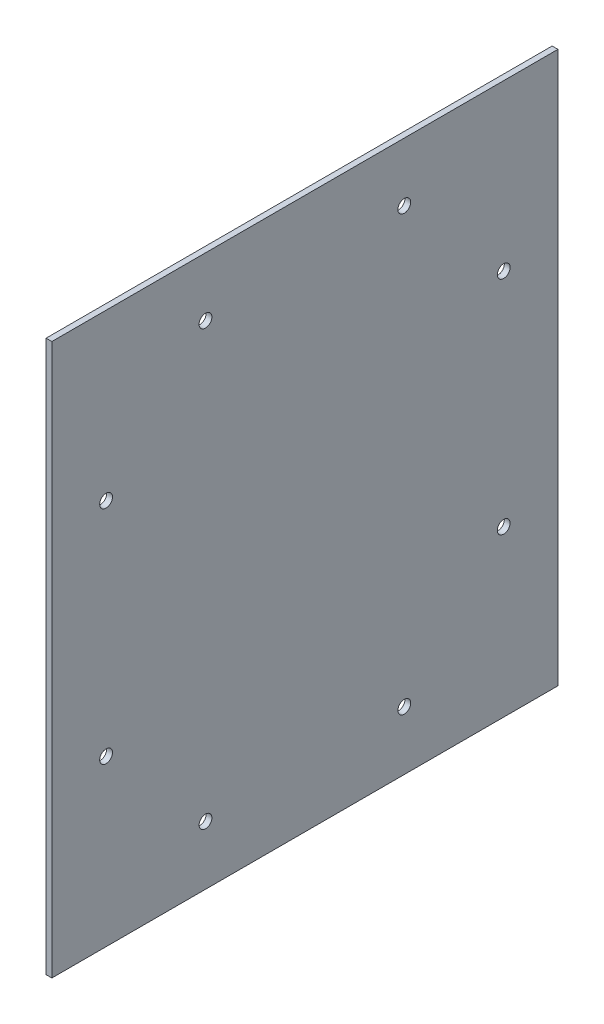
SolidWorks part; units mm, degrees
ref_plane "X-Y Datum" through (0, 0, 0) normal (0, 0, 1) x (1, 0, 0)
ref_plane "X-Z Datum" through (0, 0, 0) normal (0, 1, 0) x (1, 0, 0)
ref_plane "Y-Z Datum" through (0, 0, 0) normal (1, 0, 0) x (0, 0, -1)
sketch "Sketch1" plane through (0, 0, 0) normal (1, 0, 0) x (0, 0, -1)
  line L0 (69.85, -152.4) -> (-69.85, -152.4) construction
  line L1 (-177.8, -193.675) -> (177.8, -193.675)
  line L2 (-177.8, -193.675) -> (-177.8, 193.675)
  line L3 (-177.8, 193.675) -> (177.8, 193.675)
  line L4 (177.8, -193.675) -> (177.8, 193.675)
  line L5 (-177.8, -193.675) -> (177.8, 193.675) construction
  line L6 (-177.8, 193.675) -> (177.8, -193.675) construction
  line L7 (-139.7, -77.7875) -> (-139.7, 77.7875) construction
  line L8 (-69.85, -152.4) -> (-139.7, -77.7875) construction
  line L9 (55, 0) -> (-55, 0) construction
  line L10 (0, 55) -> (0, -55) construction
  line L11 (69.85, -152.4) -> (139.7, -77.7875) construction
  line L12 (139.7, -77.7875) -> (139.7, 77.7875) construction
  line L13 (139.7, 77.7875) -> (69.85, 152.4) construction
  line L14 (69.85, 152.4) -> (-69.85, 152.4) construction
  line L15 (-69.85, 152.4) -> (-139.7, 77.7875) construction
  circle A0 centre (69.85, -152.4) radius 4.0005
  circle A1 centre (-69.85, -152.4) radius 4.0005
  circle A2 centre (-139.7, -77.7875) radius 4.0005
  circle A3 centre (-139.7, 77.7875) radius 4.0005
  circle A4 centre (69.85, 152.4) radius 4.0005
  circle A5 centre (-69.85, 152.4) radius 4.0005
  circle A6 centre (139.7, 77.7875) radius 4.0005
  circle A7 centre (139.7, -77.7875) radius 4.0005
  point P0 (0, 0)
  point P10 (0, -152.4)
  point P15 (-139.7, 0)
  dimension "D4" = 8.001
  dimension "D1" = 387.35
  dimension "D2" = 355.6
  dimension "D3" = 41.275
  dimension "D5" = 139.7
  dimension "D6" = 155.575
  dimension "D7" = 38.1
  dimension "D8" = 102.2059
extrude "Boss-Extrude1" add sketch "Sketch1" along normal blind 4.064 contours L1 L4 L3 L2 A6 A4 A3 A2 A1 A0 A5 A7 | A1 | A0 | A7 | A6 | A4 | A5 | A3 | A2
hole_wizard "M8 Clearance Hole1" positions "Sketch2" profile "Sketch3" hole size "M8" standard "ANSI Metric"
sketch "Sketch2" plane through (4.064, 0, 0) normal (1, 0, 0) x (0, 0, -1)
  point P0 (-139.7, 77.7875)
  point P3 (-69.85, 152.4)
  point P6 (69.85, 152.4)
  point P9 (139.7, 77.7875)
  point P12 (139.7, -77.7875)
  point P15 (69.85, -152.4)
  point P18 (-69.85, -152.4)
  point P21 (-139.7, -77.7875)
sketch "Sketch3" plane through (4.064, 77.7875, 139.7) normal (0, 1, 0) x (0, 0, -1)
  line L0 (0, 0) -> (0, 4.064)
  line L1 (0, 4.064) -> (4.5, 4.064)
  line L2 (4.5, 4.064) -> (4.5, 0)
  line L5 (4.5, 0) -> (0, 0)
  line L11 (0, -6.35) -> (0, 107.95) construction
  dimension "Thru Hole Dia." = 9
  dimension "Thru Hole Depth" = 4.064
